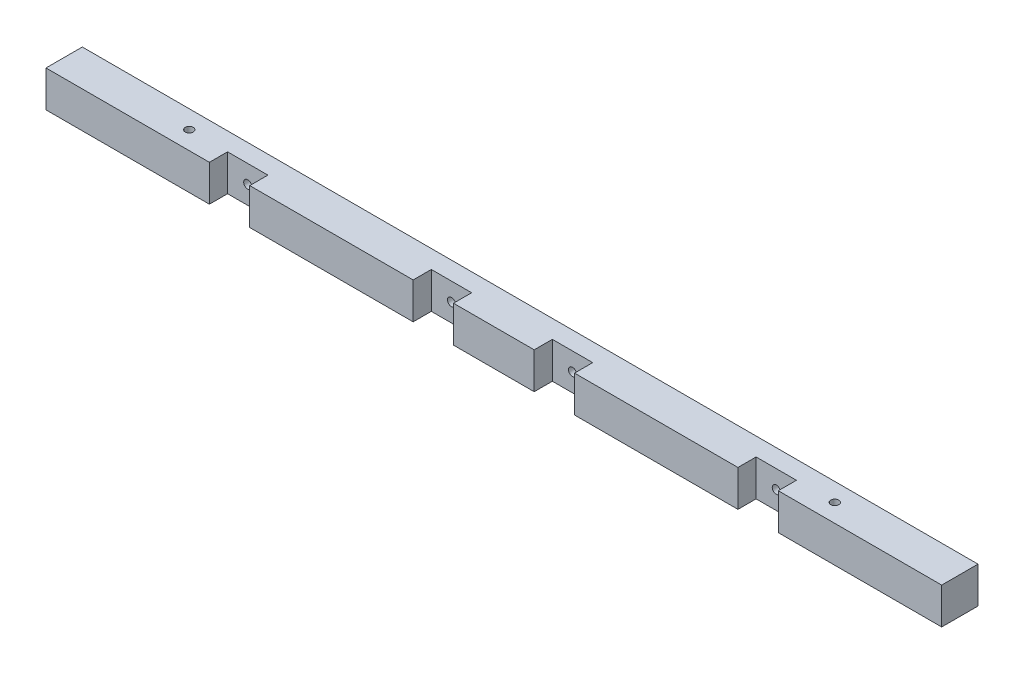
SolidWorks part; units mm, degrees
ref_plane "Plan de face" through (0, 0, 0) normal (0, 0, 1) x (1, 0, 0)
ref_plane "Plan de dessus" through (0, 0, 0) normal (0, 1, 0) x (1, 0, 0)
ref_plane "Plan de droite" through (0, 0, 0) normal (1, 0, 0) x (0, 0, -1)
sketch "Esquisse1" plane through (0, 0, 0) normal (0, 0, 1) x (1, 0, 0)
  line L1 (0, 0) -> (222, 0)
  line L2 (0, 0) -> (0, 9)
  line L3 (0, 9) -> (222, 9)
  line L4 (222, 0) -> (222, 9)
  dimension "D1" = 222
  dimension "D2" = 9
extrude "Extrusion1" add sketch "Esquisse1" along normal blind 9
sketch "Esquisse2" plane through (0, 0, 9) normal (0, 0, 1) x (1, 0, 0)
  line L0 (222, 9) -> (0, 9) construction
  line L1 (40.5, 9) -> (50.5, 9)
  line L2 (40.5, 9) -> (40.5, 0)
  line L3 (40.5, 0) -> (50.5, 0)
  line L4 (50.5, 9) -> (50.5, 0)
  line L5 (0, 0) -> (222, 0) construction
  dimension "D1" = 40.5
  dimension "D2" = 10
extrude "Enlèv. mat.-Extru.1" cut sketch "Esquisse2" against normal blind 4.5
sketch "Esquisse3" plane through (0, 0, 4.5) normal (0, 0, 1) x (1, 0, 0)
  line L0 (40.5, 9) -> (40.5, 0) construction
  line L1 (40.5, 0) -> (50.5, 0) construction
  circle A0 centre (45.5, 4.5) radius 1
  dimension "D3" = 2
  dimension "D1" = 5
  dimension "D2" = 4.5
extrude "Enlèv. mat.-Extru.2" cut sketch "Esquisse3" against normal blind 4.5
sketch "Esquisse4" plane through (0, 0, 9) normal (0, 0, 1) x (1, 0, 0)
  line L0 (50.5, 0) -> (222, 0) construction
  line L1 (91, 0) -> (101, 0)
  line L2 (91, 0) -> (91, 9)
  line L3 (91, 9) -> (101, 9)
  line L4 (101, 0) -> (101, 9)
  line L5 (222, 9) -> (50.5, 9) construction
  dimension "D1" = 40.5
  dimension "D2" = 10
extrude "Enlèv. mat.-Extru.3" cut sketch "Esquisse4" against normal blind 4.5
sketch "Esquisse5" plane through (0, 0, 4.5) normal (0, 0, 1) x (1, 0, 0)
  line L0 (91, 9) -> (91, 0) construction
  line L1 (101, 9) -> (91, 9) construction
  circle A0 centre (96, 4.5) radius 1
  dimension "D3" = 2
  dimension "D1" = 5
  dimension "D2" = 4.5
extrude "Enlèv. mat.-Extru.4" cut sketch "Esquisse5" against normal blind 4.5
sketch "Esquisse6" plane through (0, 0, 9) normal (0, 0, 1) x (1, 0, 0)
  line L0 (101, 0) -> (222, 0) construction
  line L1 (121, 0) -> (131, 0)
  line L2 (121, 0) -> (121, 9)
  line L3 (121, 9) -> (131, 9)
  line L4 (131, 0) -> (131, 9)
  line L5 (222, 9) -> (101, 9) construction
  dimension "D1" = 20
  dimension "D2" = 10
extrude "Enlèv. mat.-Extru.5" cut sketch "Esquisse6" against normal blind 4.5
sketch "Esquisse7" plane through (0, 0, 4.5) normal (0, 0, 1) x (1, 0, 0)
  line L0 (121, 9) -> (121, 0) construction
  line L1 (131, 9) -> (121, 9) construction
  circle A0 centre (126, 4.5) radius 1
  dimension "D3" = 2
  dimension "D1" = 5
  dimension "D2" = 4.5
extrude "Enlèv. mat.-Extru.6" cut sketch "Esquisse7" against normal blind 4.5
sketch "Esquisse8" plane through (0, 0, 9) normal (0, 0, 1) x (1, 0, 0)
  line L1 (171.5, 0) -> (181.5, 0)
  line L2 (171.5, 0) -> (171.5, 9)
  line L3 (171.5, 9) -> (181.5, 9)
  line L4 (181.5, 0) -> (181.5, 9)
  dimension "D1" = 10
  dimension "D2" = 40.5
extrude "Enlèv. mat.-Extru.7" cut sketch "Esquisse8" against normal blind 4.5
sketch "Esquisse9" plane through (0, 0, 4.5) normal (0, 0, 1) x (1, 0, 0)
  line L0 (171.5, 9) -> (171.5, 0) construction
  line L1 (181.5, 9) -> (171.5, 9) construction
  circle A0 centre (176.5, 4.5) radius 1
  dimension "D3" = 2
  dimension "D1" = 5
  dimension "D2" = 4.5
extrude "Enlèv. mat.-Extru.8" cut sketch "Esquisse9" against normal blind 4.5
sketch "Esquisse10" plane through (0, 9, 0) normal (0, 1, 0) x (1, 0, 0)
  line L0 (0, -9) -> (0, 0) construction
  line L1 (40.5, -9) -> (0, -9) construction
  circle A0 centre (31, -4.5) radius 1
  point P2 (0, -4.5)
  dimension "D3" = 2
  dimension "D1" = 31
  dimension "D2" = 4.5
extrude "Enlèv. mat.-Extru.9" cut sketch "Esquisse10" against normal blind 9
sketch "Esquisse11" plane through (0, 9, 0) normal (0, 1, 0) x (1, 0, 0)
  line L0 (222, 0) -> (0, 0) construction
  line L1 (222, -9) -> (222, 0) construction
  circle A0 centre (191, -4.5) radius 1
  dimension "D3" = 2
  dimension "D1" = 4.5
  dimension "D2" = 31
extrude "Enlèv. mat.-Extru.10" cut sketch "Esquisse11" against normal blind 9
